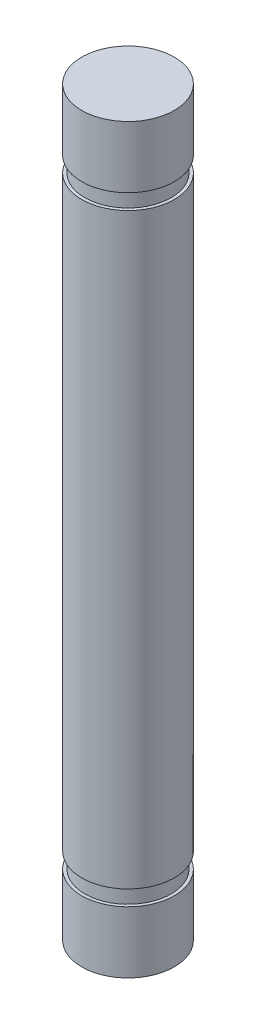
SolidWorks part; units mm, degrees
ref_plane "Front Plane" through (0, 0, 0) normal (0, 0, 1) x (1, 0, 0)
ref_plane "Top Plane" through (0, 0, 0) normal (0, 1, 0) x (1, 0, 0)
ref_plane "Right Plane" through (0, 0, 0) normal (1, 0, 0) x (0, 0, -1)
sketch "Sketch1" plane through (0, 0, 0) normal (0, 1, 0) x (1, 0, 0)
  circle A0 centre (0, 0) radius 1.5
  dimension "D1" = 3
extrude "Boss-Extrude1" add sketch "Sketch1" along normal mid plane 19.05
sketch "Sketch2" plane through (0, 9.525, 0) normal (0, 1, 0) x (1, 0, 0)
  circle A0 centre (0, 0) radius 1.4
  dimension "D1" = 2.8
extrude "Boss-Extrude2" add sketch "Sketch2" along normal blind 0.5
sketch "Sketch3" plane through (0, 10.025, 0) normal (0, 1, 0) x (1, 0, 0)
  circle A0 centre (0, 0) radius 1.5
  dimension "D1" = 3
extrude "Boss-Extrude3" add sketch "Sketch3" along normal blind 2
mirror "Mirror1" about plane through (0, 0, 0) normal (0, 1, 0) of "Boss-Extrude3", "Boss-Extrude2"
